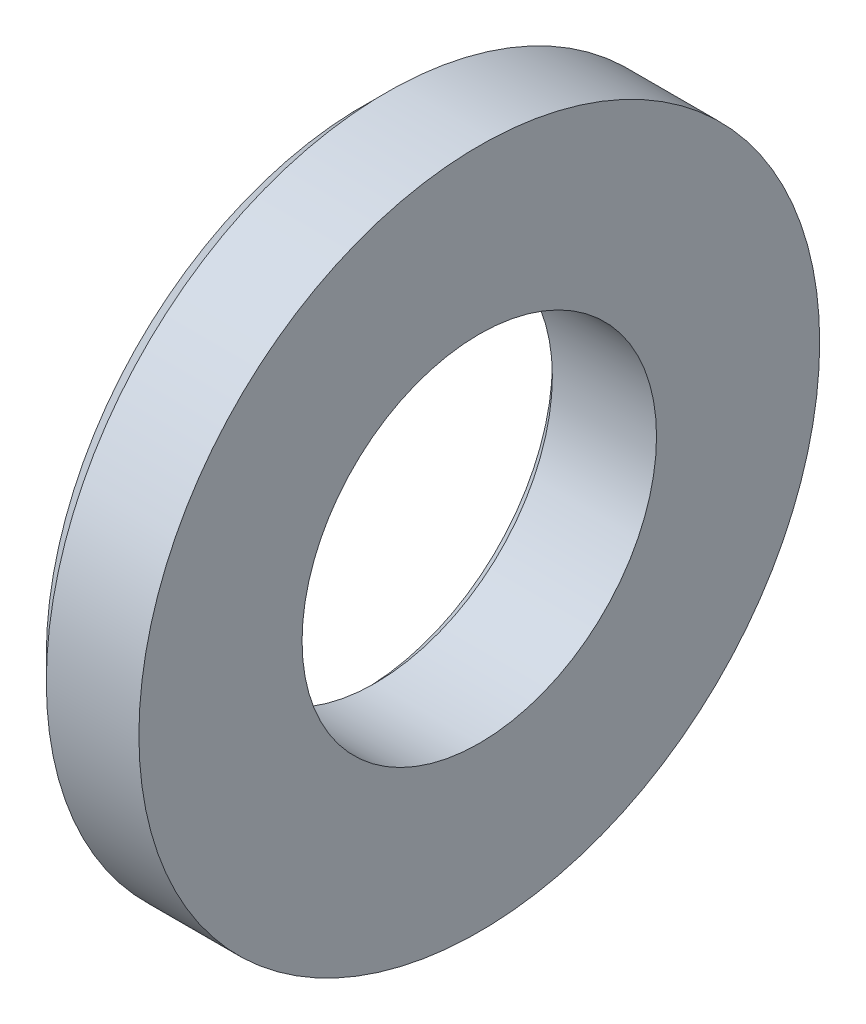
SolidWorks part; units mm, degrees
ref_plane "Front Plane" through (0, 0, 0) normal (0, 0, 1) x (1, 0, 0)
ref_plane "Top Plane" through (0, 0, 0) normal (0, 1, 0) x (1, 0, 0)
ref_plane "Right Plane" through (0, 0, 0) normal (1, 0, 0) x (0, 0, -1)
sketch "Sketch1" plane through (0, 0, 0) normal (1, 0, 0) x (0, 0, -1)
  circle A0 centre (0, 0) radius 9.9187
  circle A1 centre (0, 0) radius 19.05
  point P4 (0, -9.9187)
  point P5 (-9.9187, 0)
  point P6 (9.9187, 0)
  dimension "ID" = 19.8374
  dimension "OD" = 38.1
sketch "Sketch2" plane through (0, 0, 0) normal (0, 0, 1) x (1, 0, 0)
  line L0 (-3.2385, 0) -> (3.2385, 0)
  point P4 (0, 0)
sketch "Sketch3" plane through (0, 0, 0) normal (1, 0, 0) x (0, 0, -1)
  circle A0 centre (0, 0) radius 9.9187 construction
  circle A1 centre (0, 0) radius 19.05 construction
  circle A2 centre (0, 0) radius 9.9187
  circle A3 centre (0, 0) radius 19.05
extrude "Boss-Extrude1" add sketch "Sketch3" along normal mid plane 6.477
chamfer "Chamfer1" distance 1.2954 angle 45 1 edges at (-3.2385, 0, -19.05)
chamfer "Chamfer2" distance 0.6477 angle 45 1 edges at (-3.2385, 0, -9.9187)
equation "\"thickness@Boss-Extrude1\"=\"Thickness@Sketch2\""
equation "\"D1@Chamfer1\"=\"Thickness@Sketch2\"/5"
equation "\"D1@Chamfer2\"=\"Thickness@Sketch2\"/10"
